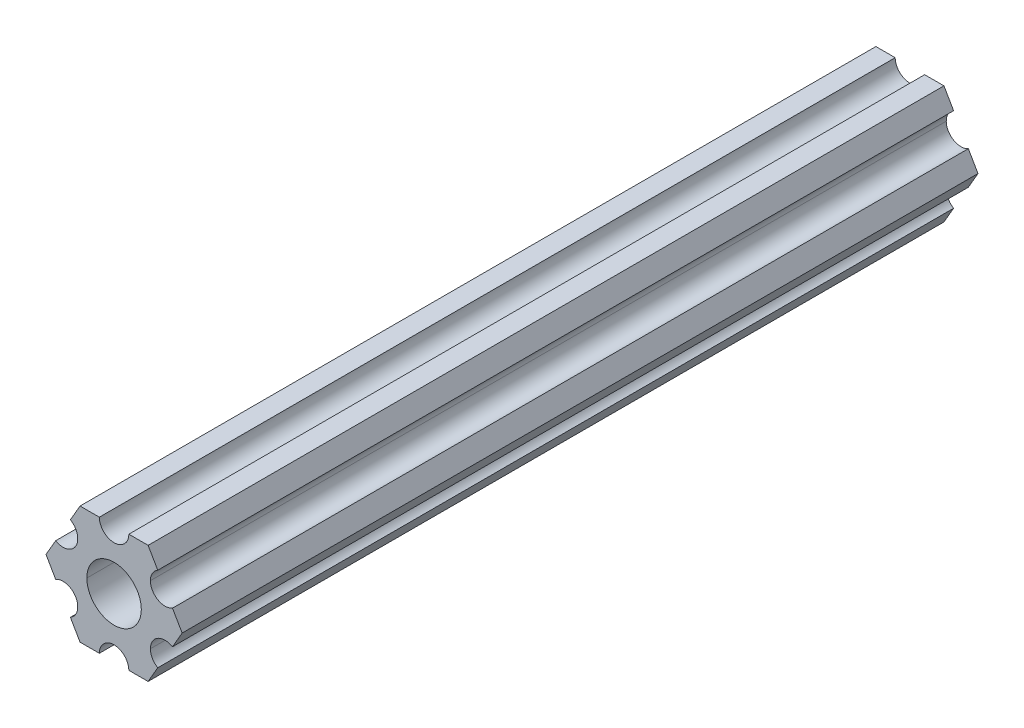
SolidWorks part; units mm, degrees
ref_plane "Front Plane" through (0, 0, 0) normal (0, 0, 1) x (1, 0, 0)
ref_plane "Top Plane" through (0, 0, 0) normal (0, 1, 0) x (1, 0, 0)
ref_plane "Right Plane" through (0, 0, 0) normal (1, 0, 0) x (0, 0, -1)
imported_body "am-churro 500 churro tube.STEP<1>"
sketch "Sketch1" plane through (0, 0, 304.8) normal (0, 0, 1) x (1, 0, 0)
  line L12 (6.293, -1.8002) -> (7.3323, 0)
  line L13 (7.3323, 0) -> (6.293, 1.8002)
  line L14 (4.7055, 4.5498) -> (3.6662, 6.35)
  line L15 (3.6662, 6.35) -> (1.5875, 6.35)
  line L16 (-1.5875, 6.35) -> (-3.6662, 6.35)
  line L17 (-3.6662, 6.35) -> (-4.7055, 4.5498)
  line L18 (-6.293, 1.8002) -> (-7.3323, 0)
  line L19 (-7.3323, 0) -> (-6.293, -1.8002)
  line L20 (-4.7055, -4.5498) -> (-3.6662, -6.35)
  line L21 (-3.6662, -6.35) -> (-1.5875, -6.35)
  line L22 (1.5875, -6.35) -> (3.6662, -6.35)
  line L23 (3.6662, -6.35) -> (4.7055, -4.5498)
  line L24 (6.293, -1.8002) -> (7.3323, 0)
  line L25 (7.3323, 0) -> (6.293, 1.8002)
  line L26 (4.7055, 4.5498) -> (3.6662, 6.35)
  line L27 (3.6662, 6.35) -> (1.5875, 6.35)
  line L28 (-1.5875, 6.35) -> (-3.6662, 6.35)
  line L29 (-3.6662, 6.35) -> (-4.7055, 4.5498)
  line L30 (-6.293, 1.8002) -> (-7.3323, 0)
  line L31 (-7.3323, 0) -> (-6.293, -1.8002)
  line L32 (-4.7055, -4.5498) -> (-3.6662, -6.35)
  line L33 (-3.6662, -6.35) -> (-1.5875, -6.35)
  line L34 (1.5875, -6.35) -> (3.6662, -6.35)
  line L35 (3.6662, -6.35) -> (4.7055, -4.5498)
  arc A8 (3.9118, 3.175) -> (6.293, 1.8002) centre (5.4993, 3.175) ccw
  arc A9 (4.7055, 4.5498) -> (3.9118, 3.175) centre (5.4993, 3.175) ccw
  arc A10 (-1.5875, 6.35) -> (1.5875, 6.35) centre (0, 6.35) ccw
  arc A11 (-6.293, 1.8002) -> (-4.7055, 4.5498) centre (-5.4993, 3.175) ccw
  arc A12 (-4.7055, -4.5498) -> (-6.293, -1.8002) centre (-5.4993, -3.175) ccw
  arc A13 (1.5875, -6.35) -> (-1.5875, -6.35) centre (0, -6.35) ccw
  arc A14 (3.9118, -3.175) -> (4.7055, -4.5498) centre (5.4993, -3.175) ccw
  arc A15 (6.293, -1.8002) -> (3.9118, -3.175) centre (5.4993, -3.175) ccw
  arc A16 (3.9118, 3.175) -> (6.293, 1.8002) centre (5.4993, 3.175) ccw
  arc A17 (4.7055, 4.5498) -> (3.9118, 3.175) centre (5.4993, 3.175) ccw
  arc A18 (-1.5875, 6.35) -> (1.5875, 6.35) centre (0, 6.35) ccw
  arc A19 (-6.293, 1.8002) -> (-4.7055, 4.5498) centre (-5.4993, 3.175) ccw
  arc A20 (-4.7055, -4.5498) -> (-6.293, -1.8002) centre (-5.4993, -3.175) ccw
  arc A21 (1.5875, -6.35) -> (-1.5875, -6.35) centre (0, -6.35) ccw
  arc A22 (3.9118, -3.175) -> (4.7055, -4.5498) centre (5.4993, -3.175) ccw
  arc A23 (6.293, -1.8002) -> (3.9118, -3.175) centre (5.4993, -3.175) ccw
  dimension "D1" = 0
extrude "Cut-Extrude1" cut sketch "Sketch1" against normal blind 219.075
